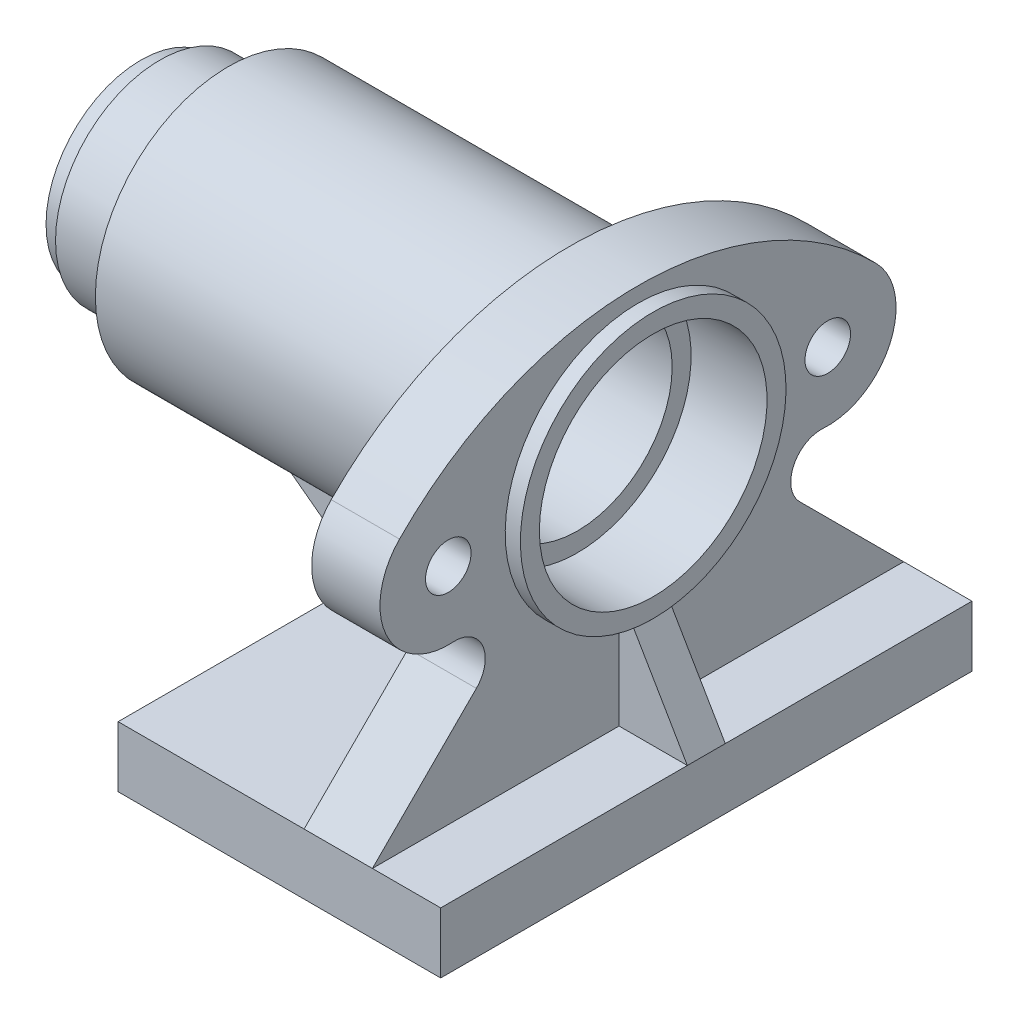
SolidWorks part; units mm, degrees
ref_plane "前视基准面" through (0, 0, 0) normal (0, 0, 1) x (1, 0, 0)
ref_plane "上视基准面" through (0, 0, 0) normal (0, 1, 0) x (1, 0, 0)
ref_plane "右视基准面" through (0, 0, 0) normal (1, 0, 0) x (0, 0, -1)
sketch "草图1" plane through (0, 0, 0) normal (0, 0, 1) x (1, 0, 0)
  line L0 (0, 0) -> (0, 16)
  line L1 (0, 16) -> (-85, 16)
  line L2 (-85, 16) -> (-85, 0)
  line L3 (-85, 0) -> (0, 0)
  dimension "D1" = 85
  dimension "D2" = 16
extrude "凸台-拉伸2" add sketch "草图1" along normal mid plane 140
ref_plane "基准面1" through (-14, 0, 0) normal (1, 0, 0) x (0, 0, -1)
sketch "草图2" plane through (0, 0, 0) normal (0, 0, 1) x (1, 0, 0)
  line L0 (-107.0679, 75) -> (-6.4484, 75) construction
  line L1 (-149, 91) -> (-149, 100)
  line L2 (-149, 100) -> (-144, 100)
  line L3 (-144, 100) -> (-144, 102.5)
  line L4 (-144, 102.5) -> (-126, 102.5)
  line L5 (-126, 102.5) -> (-126, 110)
  line L6 (-126, 110) -> (-14, 110)
  line L7 (-14, -8.8) -> (-14, 8.8) construction
  line L8 (-14, 110) -> (-14, 105)
  line L9 (-34, 100) -> (-114, 100)
  line L10 (-114, 100) -> (-114, 91)
  line L11 (-114, 91) -> (-149, 91)
  line L13 (-34, 100) -> (-34, 105)
  line L14 (-34, 105) -> (-14, 105)
  dimension "D1" = 35
  dimension "D2" = 30
  dimension "D3" = 25
  dimension "D4" = 18
  dimension "D5" = 112
  dimension "D6" = 135
  dimension "D7" = 20
  dimension "D8" = 80
  dimension "D9" = 16
  dimension "D10" = 75
  dimension "D11" = 25
  dimension "D12" = 27.5
revolve "旋转2" add sketch "草图2" angle 360 about L0
ref_plane "基准面2" through (-18, 0, 0) normal (1, 0, 0) x (0, 0, -1)
sketch "草图3" plane through (-18, 0, 0) normal (1, 0, 0) x (0, 0, -1)
  line L0 (0, -12.8905) -> (0, 132.0575) construction
  line L1 (77.2721, 75) -> (-87.1296, 75) construction
  line L2 (-50, 105.8207) -> (-50, 42.5784) construction
  line L3 (-70, 16) -> (-42.5982, 43.4018)
  line L4 (-70, 16) -> (70, 16) construction
  line L5 (-70, 16) -> (70, 16)
  line L6 (70, 16) -> (42.5982, 43.4018)
  circle A0 centre (-50, 75) radius 6
  arc A1 (-48.792, 57.0406) -> (-62.8571, 87.5974) centre (-50, 75) cw
  arc A2 (-42.5982, 43.4018) -> (-48.792, 57.0406) centre (-48.2551, 49.0586) ccw
  arc A3 (42.5982, 43.4018) -> (48.792, 57.0406) centre (48.2551, 49.0586) cw
  circle A4 centre (50, 75) radius 6
  arc A5 (48.792, 57.0406) -> (62.8571, 87.5974) centre (50, 75) ccw
  arc A6 (-62.8571, 87.5974) -> (62.8571, 87.5974) centre (0, 26.0102) cw
  circle A7 centre (0, 75) radius 35
  dimension "D2" = 12
  dimension "D3" = 18
  dimension "D4" = 8
  dimension "D6" = 88
  dimension "D7" = 70
  dimension "D1" = 50
  dimension "D5" = 45
extrude "凸台-拉伸3" add sketch "草图3" against normal blind 18
sketch "草图4" plane through (0, 0, 0) normal (0, 0, 1) x (1, 0, 0)
  line L0 (0, 16) -> (-14, 40)
  line L1 (-14, 40) -> (-14, 110) construction
rib "筋1" sketch "草图4" sketch "草图4" thickness 10 extrusion direction parallel to sketch draft on no parameters "D1"=10
sketch "草图5" plane through (0, 0, 0) normal (0, 0, 1) x (1, 0, 0)
  line L0 (-85, 16) -> (-117, 40)
  line L1 (-126, 40) -> (-36, 40) construction
  dimension "D1" = 32
rib "筋2" sketch "草图5" sketch "草图5" thickness 10 extrusion direction parallel to sketch draft on no parameters "D1"=10
